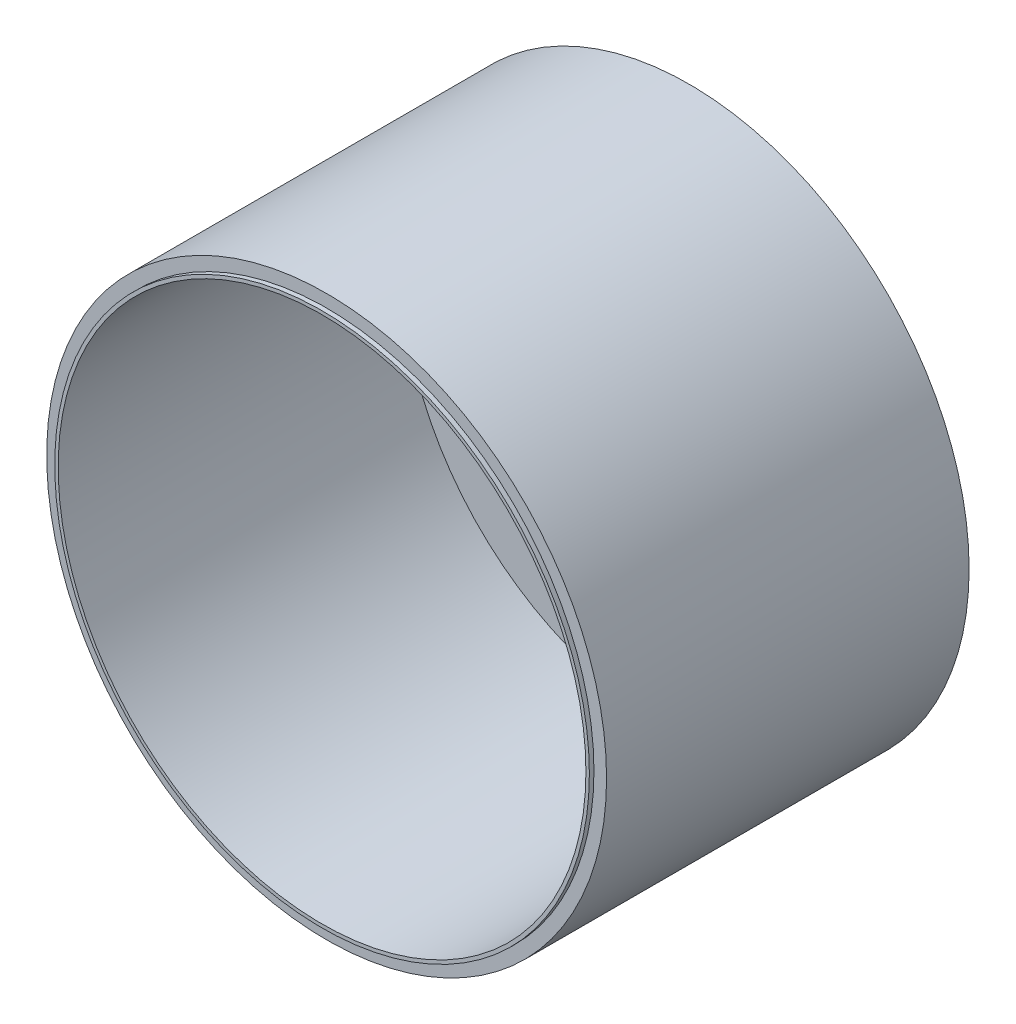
SolidWorks part; units mm, degrees
ref_plane "Front Plane" through (0, 0, 0) normal (0, 0, 1) x (1, 0, 0)
ref_plane "Top Plane" through (0, 0, 0) normal (0, 1, 0) x (1, 0, 0)
ref_plane "Right Plane" through (0, 0, 0) normal (1, 0, 0) x (0, 0, -1)
sketch "Sketch1" plane through (0, 0, 0) normal (0, 0, 1) x (1, 0, 0)
  circle A0 centre (0, 0) radius 12.2
  dimension "D1" = 24.4
extrude "Boss-Extrude1" add sketch "Sketch1" along normal blind 16
sketch "Sketch2" plane through (0, 0, 16) normal (0, 0, 1) x (1, 0, 0)
  circle A0 centre (0, 0) radius 11.65
  circle A2 centre (0, 0) radius 12.2
  dimension "D1" = 23.3
sketch "Sketch3" plane through (0, 0, 16) normal (0, 0, 1) x (1, 0, 0)
  circle A0 centre (0, 0) radius 11.5
  dimension "D1" = 23
extrude "Cut-Extrude1" cut sketch "Sketch3" against normal blind 15
extrude "Cut-Extrude2" cut sketch "Sketch2" against normal blind 0.2
